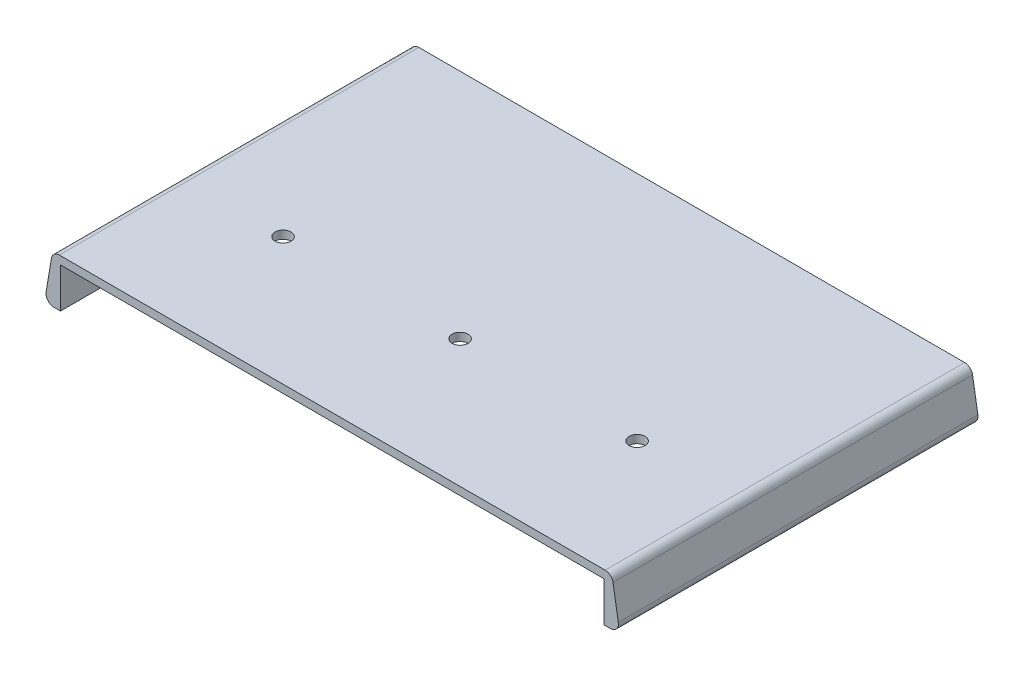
SolidWorks part; units mm, degrees
ref_plane "Front Plane" through (0, 0, 0) normal (0, 0, 1) x (1, 0, 0)
ref_plane "Top Plane" through (0, 0, 0) normal (0, 1, 0) x (1, 0, 0)
ref_plane "Right Plane" through (0, 0, 0) normal (1, 0, 0) x (0, 0, -1)
sketch "Sketch1" plane through (0, 0, 0) normal (0, 0, 1) x (1, 0, 0)
  line L0 (-215.9, 0) -> (215.9, 0)
  line L1 (215.9, 0) -> (215.9, -31.75)
  line L2 (215.9, -31.75) -> (221.1041, -31.75)
  line L3 (227.3677, -24.3561) -> (223.1343, 1.0439)
  line L4 (216.8707, 6.35) -> (-216.8707, 6.35)
  line L5 (0, 0) -> (0, 6.35) construction
  line L6 (-227.3677, -24.3561) -> (-223.1343, 1.0439)
  line L7 (-215.9, -31.75) -> (-221.1041, -31.75)
  line L8 (-215.9, 0) -> (-215.9, -31.75)
  arc A0 (221.1041, -31.75) -> (227.3677, -24.3561) centre (221.1041, -25.4) ccw
  arc A1 (223.1343, 1.0439) -> (216.8707, 6.35) centre (216.8707, 0) ccw
  arc A2 (-223.1343, 1.0439) -> (-216.8707, 6.35) centre (-216.8707, 0) cw
  arc A3 (-221.1041, -31.75) -> (-227.3677, -24.3561) centre (-221.1041, -25.4) cw
  point P10 (228.6, -31.75)
  point P13 (222.25, 6.35)
  dimension "D6" = 6.35
  dimension "D1" = 431.8
  dimension "D2" = 31.75
  dimension "D3" = 12.7
  dimension "D4" = 6.35
  dimension "D5" = 6.35
extrude "Extrude1" add sketch "Sketch1" along normal blind 285.75
sketch "Sketch2" plane through (0, 6.35, 0) normal (0, 1, 0) x (1, 0, 0)
  line L0 (-216.8707, -285.75) -> (-216.8707, 0) construction
  line L1 (216.8707, -285.75) -> (216.8707, 0) construction
  line L2 (216.8707, 0) -> (-216.8707, 0) construction
  spline S0 degree 3 poles (191.4707, -25.4) (165.4101, -36.4884) (113.8994, -58.4052) (37.1756, -8.1765) (-39.2174, -61.6873) (-114.7305, -11.7743) (-167.2335, -33.0019) (-191.4707, -44.45) knots 0 0 0 0 0.203821 0.402866 0.601911 0.800955 1 1 1 1
  dimension "D1" = 25.4
  dimension "D2" = 25.4
  dimension "D3" = 44.45
  dimension "D4" = 25.4
  dimension "D5" = 76.2
  dimension "D6" = 76.2
  dimension "D7" = 76.2
  dimension "D8" = 76.2
ref_plane "Plane1" [suppressed] through (-191.4707, 6.35, 44.45) normal (-0.9042, 0, 0.4271) x (0.4271, 0, 0.9042)
sketch "Sketch3" [suppressed] plane through (-191.4707, 6.35, 44.45) normal (-0.9042, 0, 0.4271) x (0.4271, 0, 0.9042)
  ellipse E0 centre (0, 0) end of major axis (6.7486, 0) minor radius 1.2489
sweep "Cut-Sweep1" [suppressed] cut profiles "Sketch3" path "Sketch2"
sketch "Sketch4" [suppressed] plane through (-173.7108, 0, 82.0501) normal (0.9042, 0, -0.4271) x (-0.4271, 0, -0.9042)
  line L1 (48.332, 6.35) -> (34.8348, 6.35)
  line L2 (48.332, 6.35) -> (34.8348, 6.35)
  ellipse E1 centre (41.5834, 6.35) end of major axis (34.8348, 6.35) minor radius 1.2489 (34.8348, 6.35) -> (48.332, 6.35) ccw
  ellipse E2 centre (41.5834, 6.35) end of major axis (34.8348, 6.35) minor radius 1.2489 (34.8348, 6.35) -> (48.332, 6.35) ccw
  dimension "D1" = 0
revolve "Cut-Revolve1" [suppressed] cut sketch "Sketch4" angle 360 about L2
sketch "Sketch5" [suppressed] plane through (152.9705, 0, -65.0862) normal (-0.9202, 0, 0.3915) x (0.3915, 0, 0.9202)
  line L1 (105.0848, 6.35) -> (91.5877, 6.35)
  line L2 (105.0848, 6.35) -> (91.5877, 6.35)
  ellipse E1 centre (98.3363, 6.35) end of major axis (105.0848, 6.35) minor radius 1.2489 (91.5877, 6.35) -> (105.0848, 6.35) ccw
  ellipse E2 centre (98.3363, 6.35) end of major axis (105.0848, 6.35) minor radius 1.2489 (91.5877, 6.35) -> (105.0848, 6.35) ccw
  dimension "D1" = 0
revolve "Cut-Revolve2" [suppressed] cut sketch "Sketch5" angle 360 about L2
fillet "Fillet1" [suppressed] radius 2.54
pattern_linear "LPattern1" [suppressed] count 8 spacing 30.48
sketch "Sketch6" plane through (0, 6.35, 0) normal (0, 1, 0) x (1, 0, 0)
  line L0 (-140.6707, -184.15) -> (140.6707, -184.15) construction
  line L3 (216.8707, -285.75) -> (-216.8707, -285.75) construction
  line L4 (0, -184.15) -> (0, 0) construction
  line L5 (216.8707, 0) -> (-216.8707, 0) construction
  line L7 (216.8707, -285.75) -> (216.8707, 0) construction
  circle A0 centre (-140.6707, -184.15) radius 6.35
  dimension "D2" = 12.7
  dimension "D3" = 76.2
  dimension "D1" = 101.6
extrude "Extrude2" cut sketch "Sketch6" against normal through all
sketch "Sketch7" plane through (0, 6.35, 0) normal (0, 1, 0) x (1, 0, 0)
  line L0 (-140.6707, -184.15) -> (140.6707, -184.15) construction
  line L1 (-140.6707, -184.15) -> (140.6707, -184.15)
pattern_curve "CrvPattern1" of "Extrude2" parameters "D1"=3, "D3"=2.54, "D2"=1, "D4"=2.54
